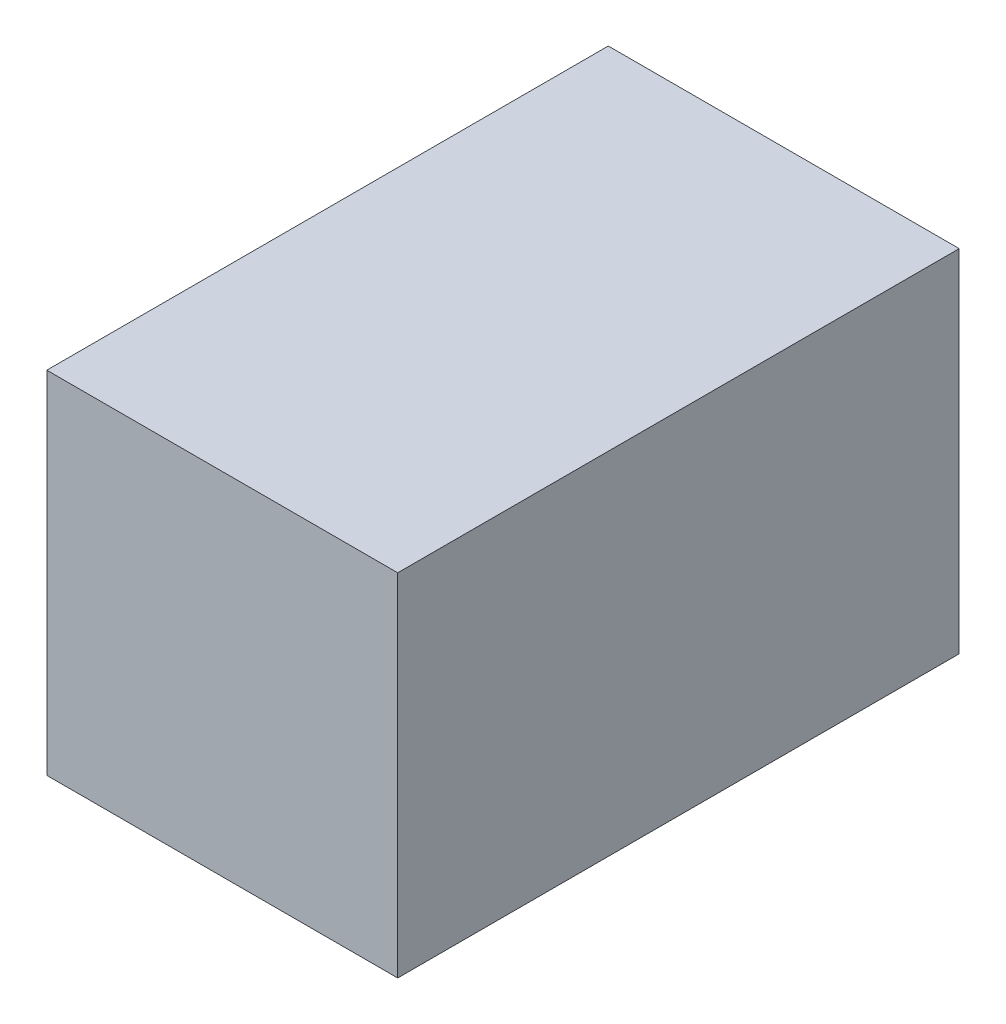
SolidWorks part; units mm, degrees
ref_plane "Front" through (0, 0, 0) normal (0, 0, 1) x (1, 0, 0)
ref_plane "Top" through (0, 0, 0) normal (0, 1, 0) x (1, 0, 0)
ref_plane "Right" through (0, 0, 0) normal (1, 0, 0) x (0, 0, -1)
other "Configuration Table"
sketch "sketch1" plane through (0, 0, 0) normal (0, 0, 1) x (1, 0, 0)
  line L0 (1.1906, 1.1906) -> (-1.1906, -1.1906) construction
  line L1 (-1.1906, 1.1906) -> (1.1906, 1.1906)
  line L2 (-1.1906, 1.1906) -> (-1.1906, -1.1906)
  line L3 (-1.1906, -1.1906) -> (1.1906, -1.1906)
  line L4 (1.1906, 1.1906) -> (1.1906, -1.1906)
  dimension "W" = 2.3813
  dimension "H" = 2.3813
extrude "Extrude1" add sketch "sketch1" along normal blind 3.81
